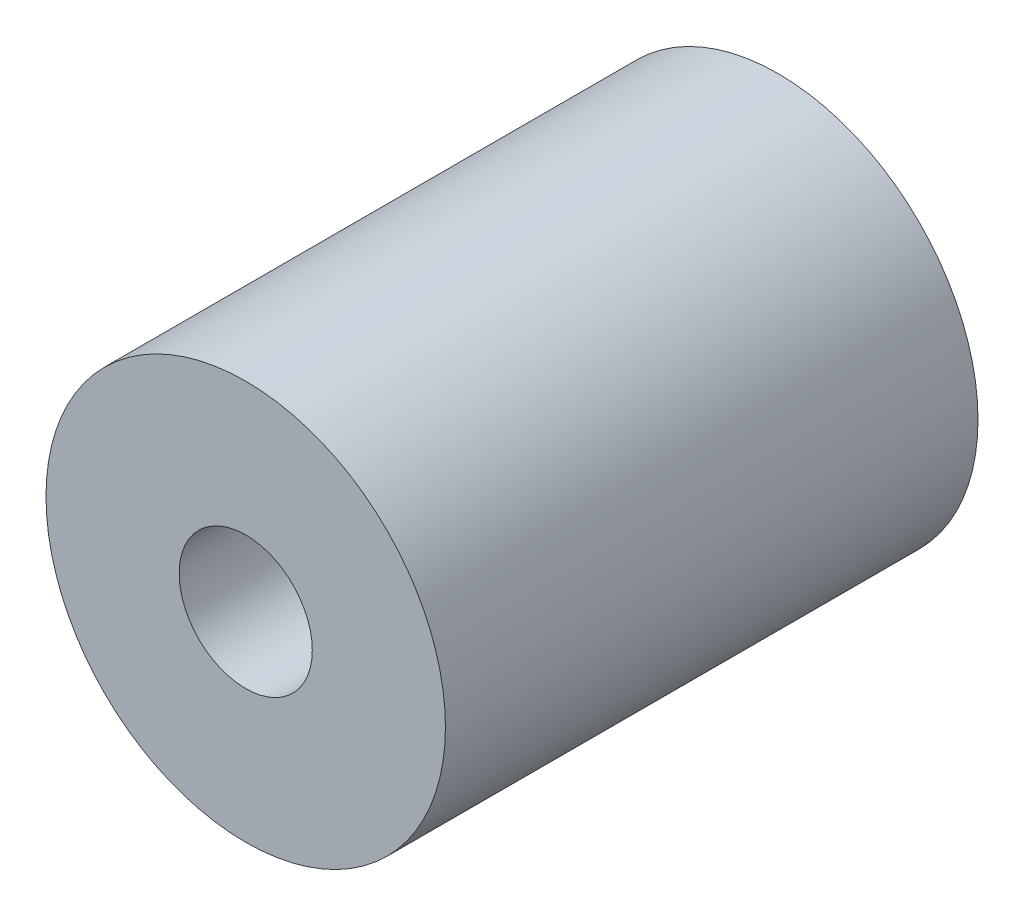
SolidWorks part; units mm, degrees
ref_plane "Front Plane" through (0, 0, 0) normal (0, 0, 1) x (1, 0, 0)
ref_plane "Top Plane" through (0, 0, 0) normal (0, 1, 0) x (1, 0, 0)
ref_plane "Right Plane" through (0, 0, 0) normal (1, 0, 0) x (0, 0, -1)
sketch "Sketch1" plane through (0, 0, 0) normal (0, 0, 1) x (1, 0, 0)
  circle A0 centre (0, 0) radius 3
  dimension "D1" = 6
extrude "Boss-Extrude1" add sketch "Sketch1" along normal mid plane 8
sketch "Sketch3" plane through (0, 0, 0) normal (0, 0, 1) x (1, 0, 0)
  circle A0 centre (0, 0) radius 1
  dimension "D1" = 2
extrude "displacer rod guide" cut sketch "Sketch3" against normal through all both and the other way through all
